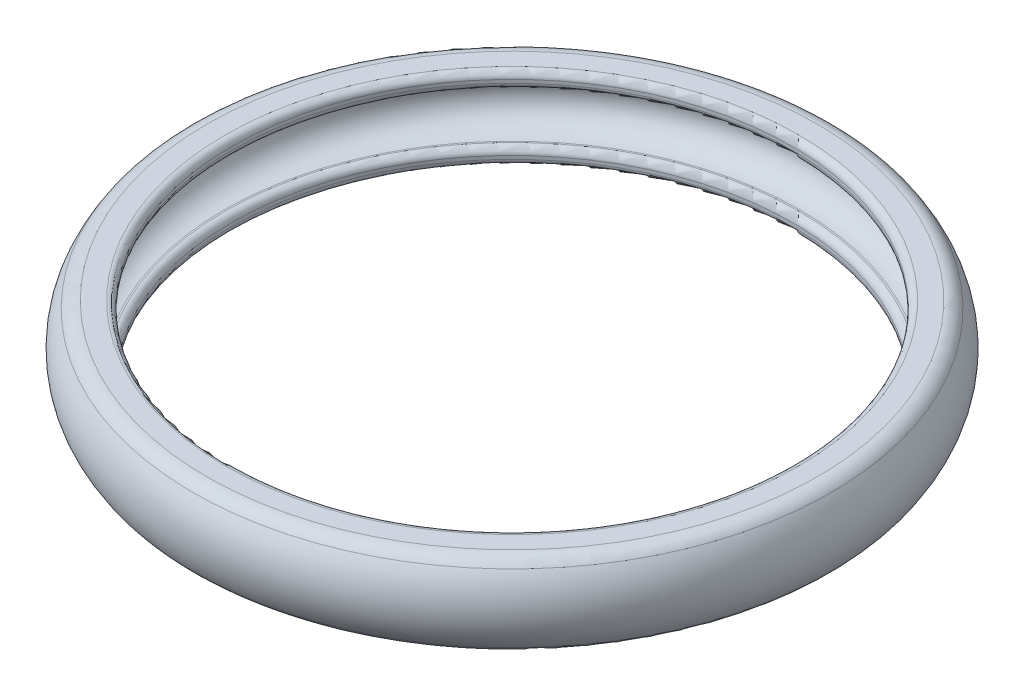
SolidWorks part; units mm, degrees
ref_plane "前视基准面" through (0, 0, 0) normal (0, 0, 1) x (1, 0, 0)
ref_plane "上视基准面" through (0, 0, 0) normal (0, 1, 0) x (1, 0, 0)
ref_plane "右视基准面" through (0, 0, 0) normal (1, 0, 0) x (0, 0, -1)
sketch "草图1" plane through (0, 0, 0) normal (0, 0, 1) x (1, 0, 0)
  line L0 (0, 18.5238) -> (0, -10.9048) construction
  line L2 (17.4, 0) -> (18.5292, 0)
  line L3 (17, 0.4) -> (17, 0.6)
  line L4 (17.4, 5) -> (18.5292, 5)
  line L6 (19, 5.7484) -> (19, -1.0538) construction
  line L7 (15.6947, 4) -> (19.3705, 4) construction
  line L8 (15.6947, 1) -> (19.3705, 1) construction
  line L9 (17.5, 5.6525) -> (17.5, -0.1978) construction
  line L10 (17, 4.4) -> (17, 4.6)
  line L11 (17.4, 4) -> (17.5, 4)
  line L12 (17.4, 1) -> (17.5, 1)
  arc A0 (17.5, 1) -> (17.5, 4) centre (17.5, 2.5) ccw
  arc A1 (19.3499, 4.5714) -> (19.3499, 0.4286) centre (16.375, 2.5) cw
  arc A2 (17.4, 0) -> (17, 0.4) centre (17.4, 0.4) cw
  arc A3 (17, 0.6) -> (17.4, 1) centre (17.4, 0.6) cw
  arc A4 (17, 4.4) -> (17.4, 4) centre (17.4, 4.4) ccw
  arc A5 (17, 4.6) -> (17.4, 5) centre (17.4, 4.6) cw
  arc A6 (19.3499, 0.4286) -> (18.5292, 0) centre (18.5292, 1) cw
  arc A7 (19.3499, 4.5714) -> (18.5292, 5) centre (18.5292, 4) ccw
  point P22 (17, 1)
  point P28 (17, 4)
  point P33 (19, 0)
  point P36 (19, 5)
  dimension "D3" = 1
  dimension "D1" = 20
  dimension "D2" = 0.4
  dimension "D4" = 0.5
revolve "旋转1" add sketch "草图1" angle 360 about L0
